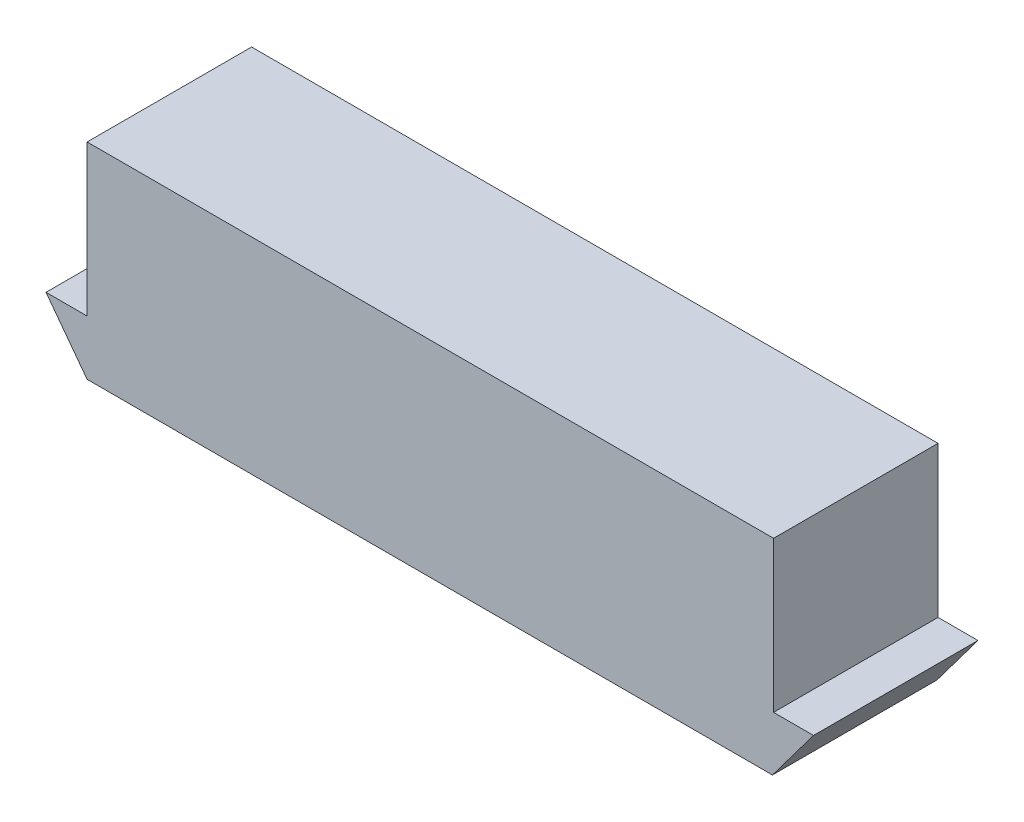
SolidWorks part; units mm, degrees
ref_plane "Front Plane" through (0, 0, 0) normal (0, 0, 1) x (1, 0, 0)
ref_plane "Top Plane" through (0, 0, 0) normal (0, 1, 0) x (1, 0, 0)
ref_plane "Right Plane" through (0, 0, 0) normal (1, 0, 0) x (0, 0, -1)
sketch "Sketch1" plane through (0, 0, 0) normal (0, 0, 1) x (1, 0, 0)
  line L1 (28, -7.5) -> (-28, -7.5)
  line L2 (28, -7.5) -> (28, 7.5)
  line L3 (28, 7.5) -> (-28, 7.5)
  line L4 (-28, -7.5) -> (-28, 7.5)
  point P0 (0, 0)
extrude "Extrude1" add sketch "Sketch1" along normal blind 12
sketch "Sketch2" plane through (0, 0, 12) normal (0, 0, 1) x (1, 0, 0)
  line L0 (-25, -7.5) -> (-28, -3.5)
  line L1 (-28, -7.5) -> (28, -7.5) construction
  line L2 (-28, 7.5) -> (-28, -7.5) construction
  line L3 (-28, -3.5) -> (-28, -7.5)
  line L4 (-28, -7.5) -> (-25, -7.5)
  line L5 (25, -7.5) -> (28, -3.5)
  line L6 (28, -7.5) -> (28, 7.5) construction
  line L7 (28, -3.5) -> (28, -7.5)
  line L8 (28, -7.5) -> (25, -7.5)
extrude "Extrude2" cut sketch "Sketch2" against normal blind 12
sketch "Sketch4" plane through (0, 0, 0) normal (0, 0, -1) x (-1, 0, 0)
  line L0 (28, -3.5) -> (28, 7.5)
  line L1 (-28, 7.5) -> (-25.0844, 7.5)
  line L3 (25, 7.5) -> (25, -3.5)
  line L4 (25, -3.5) -> (28, -3.5)
  line L5 (28, -3.5) -> (27.9061, -3.6117)
  line L6 (-28, -3.5) -> (-25.0844, -3.5)
  line L7 (-25.0844, -3.5) -> (-25.0844, 7.5)
  line L9 (-28, 7.5) -> (-28, -3.5)
  line L10 (28, 7.5) -> (25, 7.5)
extrude "Extrude4" cut sketch "Sketch4" against normal blind 12 contours L6 L7 L1 L9 | L0 L10 L3 L4
sketch "Sketch7" plane through (-25, 0, 0) normal (-1, 0, 0) x (0, 0, 1)
  point P0 (6, 0.7)
hole_wizard "CBORE for #00 Binding Head Machine Screw2" positions "3DSketch3" profile "Sketch9" counterbore size "#00" standard "Ansi Inch"
sketch3d "3DSketch3"
  point P0 (-25, 0.7, 6)
sketch "Sketch9" plane through (-25, 0.7, 6) normal (0, 1, 0) x (0, 0, 1)
  line L0 (0, 0) -> (0, 20.4197)
  line L1 (0, 20.4197) -> (0.6985, 20)
  line L2 (0.6985, 20) -> (0.6985, 3)
  line L3 (0.6985, 3) -> (1.5875, 3)
  line L4 (1.5875, 3) -> (1.5875, 0)
  line L5 (1.5875, 0) -> (0, 0)
  line L10 (0, 20.4197) -> (-0.6985, 20) construction
  line L11 (0, -6.35) -> (0, 107.95) construction
  dimension "Hole Dia." = 1.397
  dimension "Hole Depth" = 20
  dimension "C'Bore Dia." = 3.175
  dimension "C'Bore Depth" = 3
  dimension "Drill Angle" = 118
hole_wizard "CBORE for #00 Binding Head Machine Screw3" positions "3DSketch4" profile "Sketch10" counterbore size "#00" standard "Ansi Inch"
sketch3d "3DSketch4"
  point P0 (-25, 0.7, 6)
sketch "Sketch10" plane through (-25, 0.7, 6) normal (0, 1, 0) x (0, 0, 1)
  line L0 (0, 0) -> (0, 20.4197)
  line L1 (0, 20.4197) -> (0.6985, 20)
  line L2 (0.6985, 20) -> (0.6985, 3)
  line L3 (0.6985, 3) -> (1.5875, 3)
  line L4 (1.5875, 3) -> (1.5875, 0)
  line L5 (1.5875, 0) -> (0, 0)
  line L10 (0, 20.4197) -> (-0.6985, 20) construction
  line L11 (0, -6.35) -> (0, 107.95) construction
  dimension "Hole Dia." = 1.397
  dimension "Hole Depth" = 20
  dimension "C'Bore Dia." = 3.175
  dimension "C'Bore Depth" = 3
  dimension "Drill Angle" = 118
hole_wizard "CBORE for #00 Binding Head Machine Screw5" positions "3DSketch6" profile "Sketch13" counterbore size "#00" standard "Ansi Inch"
sketch3d "3DSketch6"
  point P0 (-25, 0.7, 6)
sketch "Sketch13" plane through (-25, 0.7, 6) normal (0, 1, 0) x (0, 0, 1)
  line L0 (0, 0) -> (0, 20.4197)
  line L1 (0, 20.4197) -> (0.6985, 20)
  line L2 (0.6985, 20) -> (0.6985, 3)
  line L3 (0.6985, 3) -> (1.5875, 3)
  line L4 (1.5875, 3) -> (1.5875, 0)
  line L5 (1.5875, 0) -> (0, 0)
  line L10 (0, 20.4197) -> (-0.6985, 20) construction
  line L11 (0, -6.35) -> (0, 107.95) construction
  dimension "Hole Dia." = 1.397
  dimension "Hole Depth" = 20
  dimension "C'Bore Dia." = 3.175
  dimension "C'Bore Depth" = 3
  dimension "Drill Angle" = 118
hole_wizard "CBORE for #00 Binding Head Machine Screw7" positions "3DSketch8" profile "Sketch16" counterbore size "#00" standard "Ansi Inch"
sketch3d "3DSketch8"
  point P0 (-25, 0.7, 6)
sketch "Sketch16" plane through (-25, 0.7, 6) normal (0, 1, 0) x (0, 0, -1)
  line L0 (0, 0) -> (0, 20.4197)
  line L1 (0, 20.4197) -> (0.6985, 20)
  line L2 (0.6985, 20) -> (0.6985, 3)
  line L3 (0.6985, 3) -> (1.5875, 3)
  line L4 (1.5875, 3) -> (1.5875, 0)
  line L5 (1.5875, 0) -> (0, 0)
  line L10 (0, 20.4197) -> (-0.6985, 20) construction
  line L11 (0, -6.35) -> (0, 107.95) construction
  dimension "Hole Dia." = 1.397
  dimension "Hole Depth" = 20
  dimension "C'Bore Dia." = 3.175
  dimension "C'Bore Depth" = 3
  dimension "Drill Angle" = 118
hole_wizard "#54 (0.055) Diameter Hole1" positions "3DSketch9" profile "Sketch17" hole size "#54" standard "Ansi Inch"
sketch3d "3DSketch9"
  point P0 (-25, 0.7, 6)
sketch "Sketch17" plane through (-25, 0.7, 6) normal (0, 1, 0) x (0, 0, 1)
  line L0 (0, 0) -> (0, 20.4197)
  line L1 (0, 20.4197) -> (0.6985, 20)
  line L2 (0.6985, 20) -> (0.6985, 0)
  line L5 (0.6985, 0) -> (0, 0)
  line L10 (0, 20.4197) -> (-0.6985, 20) construction
  line L11 (0, -6.35) -> (0, 107.95) construction
  dimension "Hole Dia." = 1.397
  dimension "Hole Depth" = 20
  dimension "Drill Angle" = 118
sketch3d "3DSketch12" plane through (0, 0, 0) normal (0, 0, 1) x (1, 0, 0)
